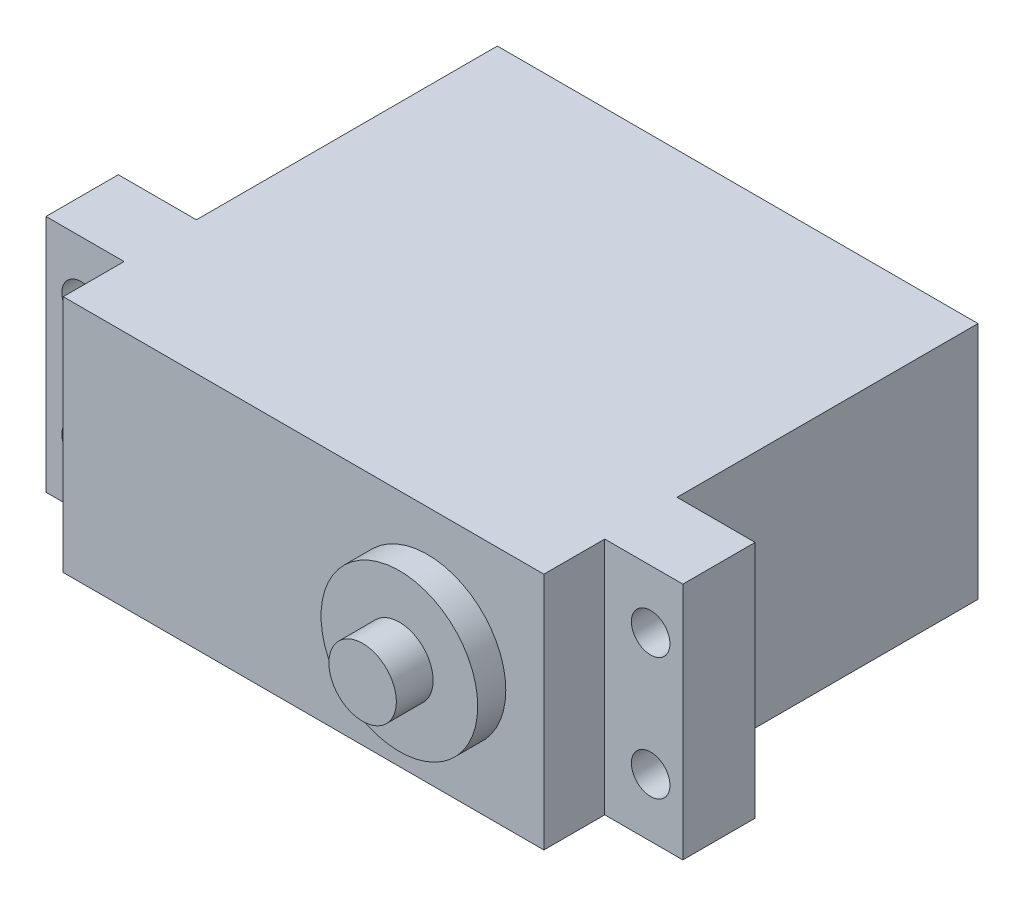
SolidWorks part; units mm, degrees
ref_plane "Plan de face" through (0, 0, 0) normal (0, 0, 1) x (1, 0, 0)
ref_plane "Plan de dessus" through (0, 0, 0) normal (0, 1, 0) x (1, 0, 0)
ref_plane "Plan de droite" through (0, 0, 0) normal (1, 0, 0) x (0, 0, -1)
sketch "Esquisse1" plane through (0, 0, 0) normal (0, 0, 1) x (1, 0, 0)
  line L1 (-30.22, 9.91) -> (9.66, 9.91)
  line L2 (-30.22, 9.91) -> (-30.22, -9.91)
  line L3 (-30.22, -9.91) -> (9.66, -9.91)
  line L4 (9.66, 9.91) -> (9.66, -9.91)
  dimension "D1" = 19.82
  dimension "D2" = 9.91
  dimension "D3" = 39.88
  dimension "D4" = 30.22
extrude "Extrusion1" add sketch "Esquisse1" along normal blind 36.02
sketch "Esquisse2" plane through (0, 0, 36.02) normal (0, 0, 1) x (1, 0, 0)
  circle A0 centre (0, 0) radius 6.5
  dimension "D1" = 13
extrude "Extrusion2" add sketch "Esquisse2" along normal blind 2.33
sketch "Esquisse3" plane through (0, 0, 38.35) normal (0, 0, 1) x (1, 0, 0)
  circle A0 centre (0, 0) radius 2.8
  dimension "D1" = 5.6
extrude "Extrusion3" add sketch "Esquisse3" along normal blind 3.05
ref_plane "Plan2" through (0, 0, 26.67) normal (0, 0, -1) x (-1, 0, 0)
sketch "Esquisse5" plane through (0, 0, 26.67) normal (0, 0, -1) x (-1, 0, 0)
  line L0 (30.22, -9.91) -> (-9.66, -9.91) construction
  line L1 (36.7, 9.91) -> (-16.14, 9.91)
  line L2 (36.7, -9.91) -> (-16.14, -9.91)
  line L3 (-9.66, 9.91) -> (30.22, 9.91) construction
  line L4 (36.7, 9.91) -> (36.7, -9.91)
  line L8 (30.22, 9.91) -> (30.22, -9.91) construction
  line L9 (-16.14, 9.91) -> (-16.14, -9.91)
  circle A0 centre (33.79, 5.085) radius 1.6
  circle A1 centre (33.79, -5.085) radius 1.6
  circle A2 centre (-13.47, 5.085) radius 1.6
  circle A3 centre (-13.47, -5.085) radius 1.6
  dimension "D5" = 3.2
  dimension "D6" = 3.2
  dimension "D7" = 3.2
  dimension "D8" = 3.2
  dimension "D1" = 52.84
  dimension "D2" = 6.48
  dimension "D3" = 10.17
  dimension "D4" = 5.085
  dimension "D9" = 33.79
  dimension "D10" = 13.47
extrude "Extrusion4" add sketch "Esquisse5" against normal blind 4.3 and the other way blind 1.7
sketch "Esquisse6" plane through (0, 0, 0) normal (0, 0, -1) x (-1, 0, 0)
  line L0 (-13.5, -25) -> (13.5, -25) construction
  line L1 (-4.5, -25) -> (4.5, -25)
  line L2 (-117.8868, 5) -> (-132.1132, 5) construction
  line L3 (-107.5, 10) -> (-142.5, 10) construction
  line L4 (-24.8586, 5) -> (-132.1132, 5)
  line L6 (-20.8255, 10) -> (-162.8894, 10)
  arc A0 (4.5, -25) -> (-4.5, -25) centre (0, 0) ccw
  circle A1 centre (0, 0) radius 25
ref_plane "Plan4" through (0, 0, 20.02) normal (0, 0, 1) x (1, 0, 0)
